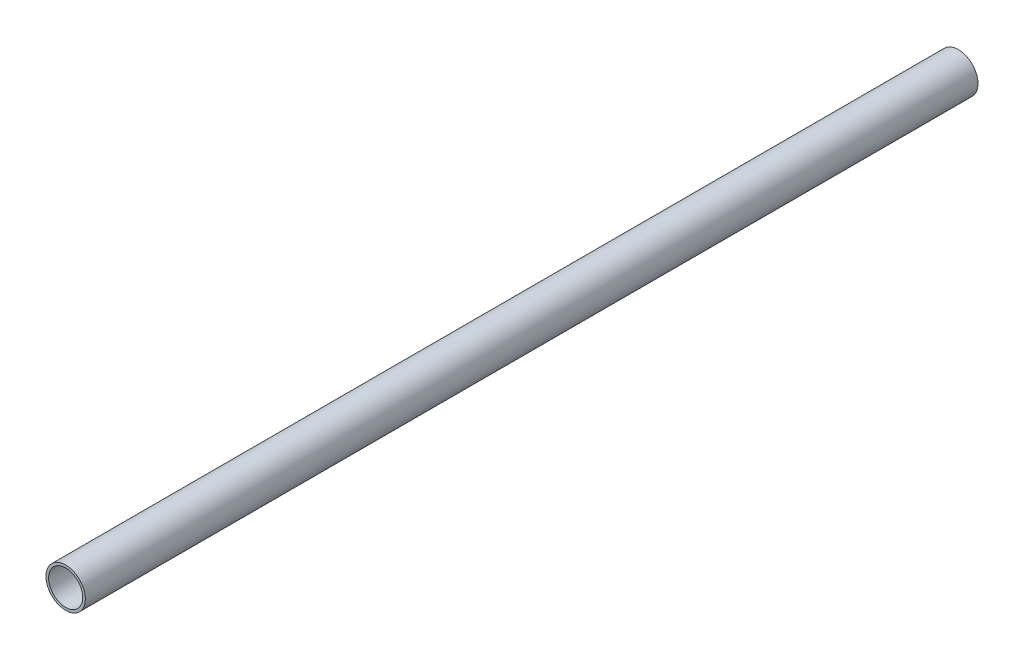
SolidWorks part; units mm, degrees
ref_plane "Plan de face" through (0, 0, 0) normal (0, 0, 1) x (1, 0, 0)
ref_plane "Plan de dessus" through (0, 0, 0) normal (0, 1, 0) x (1, 0, 0)
ref_plane "Plan de droite" through (0, 0, 0) normal (1, 0, 0) x (0, 0, -1)
sketch "Esquisse1" plane through (0, 0, 0) normal (0, 0, 1) x (1, 0, 0)
  circle A0 centre (0, 0) radius 15
  circle A1 centre (0, 0) radius 13
  dimension "D1" = 30
  dimension "D2" = 2
extrude "Boss.-Extru.1" add sketch "Esquisse1" along normal blind 680
